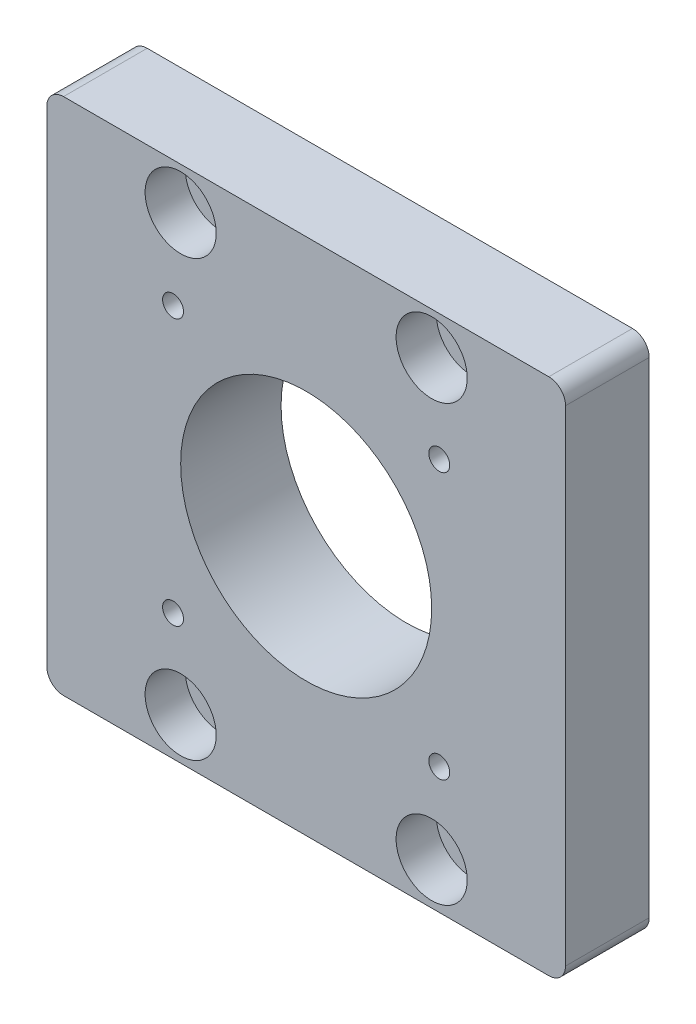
SolidWorks part; units mm, degrees
ref_plane "前视基准面" through (0, 0, 0) normal (0, 0, 1) x (1, 0, 0)
ref_plane "上视基准面" through (0, 0, 0) normal (0, 1, 0) x (1, 0, 0)
ref_plane "右视基准面" through (0, 0, 0) normal (1, 0, 0) x (0, 0, -1)
sketch "草图1" plane through (0, 0, 0) normal (0, 0, 1) x (1, 0, 0)
  line L1 (-31, -31) -> (31, -31)
  line L2 (-31, -31) -> (-31, 31)
  line L3 (-31, 31) -> (31, 31)
  line L4 (31, -31) -> (31, 31)
  line L5 (-31, -31) -> (31, 31) construction
  line L6 (-31, 31) -> (31, -31) construction
  circle A0 centre (0, 0) radius 15
  point P0 (0, 0)
  dimension "D3" = 30
  dimension "D1" = 62
  dimension "D2" = 62
extrude "凸台-拉伸1" add sketch "草图1" along normal blind 10
sketch "草图2" plane through (0, 0, 10) normal (0, 0, 1) x (1, 0, 0)
  line L0 (0, 31) -> (0, 0) construction
  line L1 (31, 31) -> (-31, 31) construction
  line L2 (0, 0) -> (-31, 0) construction
  line L3 (-31, 31) -> (-31, -31) construction
  line L4 (-15.9099, 15.9099) -> (15.9099, -15.9099) construction
  line L5 (15.9099, 15.9099) -> (-15.9099, -15.9099) construction
  circle A0 centre (-15.9099, 15.9099) radius 1.25
  circle A1 centre (15.9099, 15.9099) radius 1.25
  circle A2 centre (15.9099, -15.9099) radius 1.25
  circle A3 centre (-15.9099, -15.9099) radius 1.25
  circle A4 centre (0, 0) radius 22.5 construction
  dimension "D1" = 45
  dimension "D2" = 45
  dimension "D3" = 2.5
  dimension "D4" = 45
extrude "切除-拉伸1" cut sketch "草图2" against normal through all
sketch "草图5" plane through (0, 0, 10) normal (0, 0, 1) x (1, 0, 0)
  line L0 (0, 30) -> (0, 0) construction
  line L1 (0, 0) -> (-30, 0) construction
  line L2 (-15, 25.9808) -> (15, -25.9808) construction
  line L3 (15, 25.9808) -> (-15, -25.9808) construction
  circle A0 centre (0, 0) radius 30 construction
  circle A1 centre (-15, 25.9808) radius 2.25
  circle A2 centre (15, 25.9808) radius 2.25
  circle A3 centre (15, -25.9808) radius 2.25
  circle A4 centre (-15, -25.9808) radius 2.25
  dimension "D3" = 60
  dimension "D4" = 4.5
  dimension "D1" = 30
  dimension "D2" = 30
extrude "切除-拉伸3" cut sketch "草图5" against normal through all
sketch "草图6" plane through (0, 0, 10) normal (0, 0, 1) x (1, 0, 0)
  circle A0 centre (-15, 25.9808) radius 4.25
  circle A1 centre (15, 25.9808) radius 4.25
  circle A2 centre (15, -25.9808) radius 4.25
  circle A3 centre (-15, -25.9808) radius 4.25
  dimension "D1" = 8.5
extrude "切除-拉伸4" cut sketch "草图6" against normal blind 4.8
fillet "圆角1" radius 2 4 edges at (-31, 31, 5) (-31, -31, 5) (31, -31, 5) (31, 31, 5)
sketch "草图7" plane through (0, 0, 0) normal (0, 0, -1) x (-1, 0, 0)
  circle A0 centre (0, 0) radius 25
  circle A1 centre (0, 0) radius 15 construction
  circle A2 centre (0, 0) radius 15
  dimension "D1" = 50
extrude "凸台-拉伸2" add sketch "草图7" along normal blind 2
